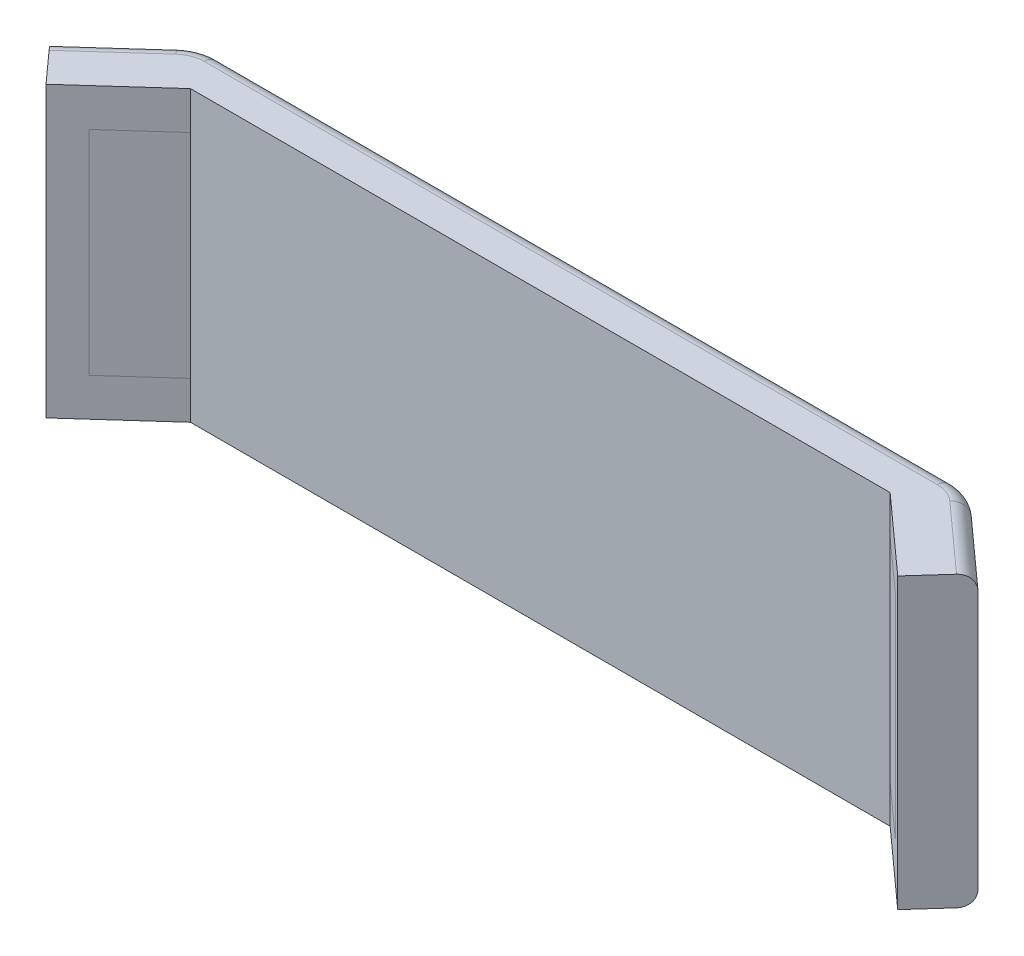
SolidWorks part; units mm, degrees
other "Solid1"
ref_plane "Front Plane" through (0, 0, 0) normal (0, 0, 1) x (1, 0, 0)
ref_plane "Top Plane" through (0, 0, 0) normal (0, 1, 0) x (1, 0, 0)
ref_plane "Right Plane" through (0, 0, 0) normal (1, 0, 0) x (0, 0, -1)
imported_body "Imported1"
sketch "Sketch1" plane through (0, 0, -3.75) normal (0, 0, -1) x (-1, 0, 0)
  line L0 (-24.1019, -1.25) -> (24.1019, -1.25) construction
  line L1 (-24.1019, 8.5) -> (-24.1019, -7.25) construction
  line L2 (24.1019, -8.5) -> (24.1019, 8.5) construction
  line L3 (-24.1019, -9.5) -> (24.1019, -9.5) construction
  text T0 "GreenLab" font "Copperplate Gothic Bold" height 2.5
  dimension "D1" = 8.25
extrude "Cut-Extrude1" cut sketch "Sketch1" against normal blind 0.5
